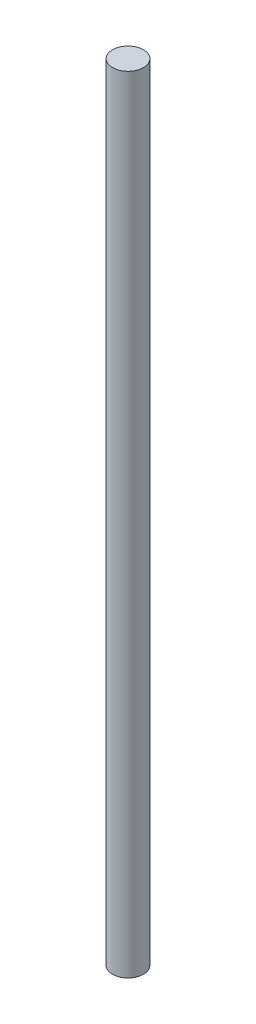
SolidWorks part; units mm, degrees
ref_plane "Plan de face" through (0, 0, 0) normal (0, 0, 1) x (1, 0, 0)
ref_plane "Plan de dessus" through (0, 0, 0) normal (0, 1, 0) x (1, 0, 0)
ref_plane "Plan de droite" through (0, 0, 0) normal (1, 0, 0) x (0, 0, -1)
sketch "Esquisse1" plane through (0, 0, 0) normal (0, 1, 0) x (1, 0, 0)
  circle A0 centre (0, 0) radius 3
  dimension "D1" = 6
extrude "Extrusion1" add sketch "Esquisse1" along normal blind 152
